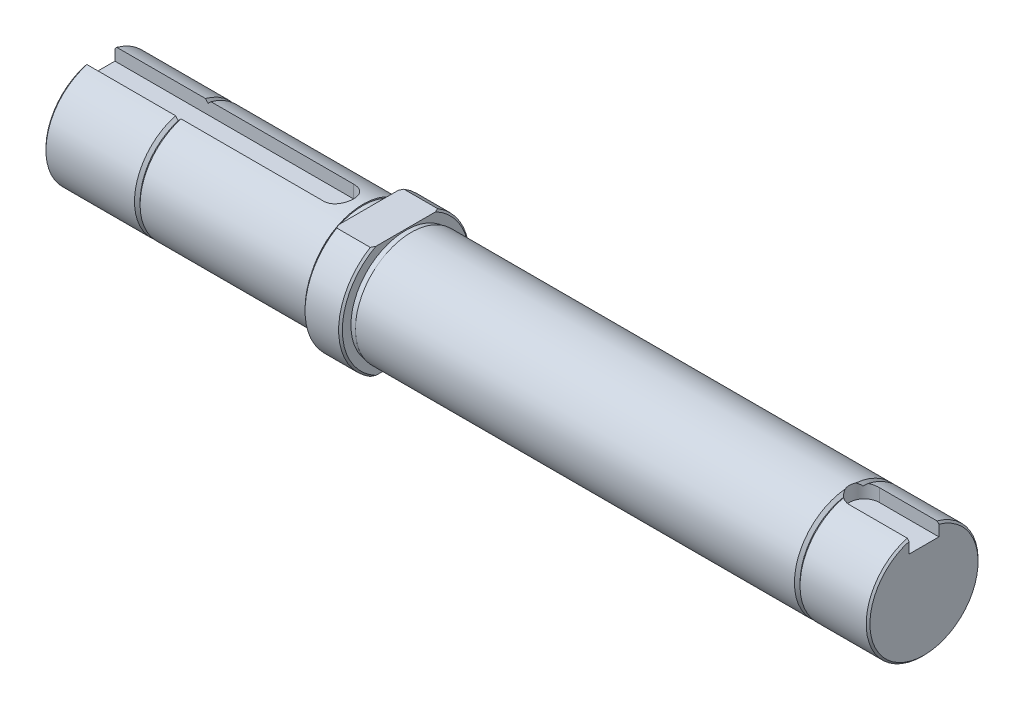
SolidWorks part; units mm, degrees
ref_plane "Front X-Y" through (0, 0, 0) normal (0, 0, 1) x (1, 0, 0)
ref_plane "Top X-Z" through (0, 0, 0) normal (0, 1, 0) x (1, 0, 0)
ref_plane "Right Y-Z" through (0, 0, 0) normal (1, 0, 0) x (0, 0, -1)
ref_plane "Plane1" through (0, 0, 0) normal (0, 0, 1) x (1, 0, 0)
sketch "Sketch1" plane through (0, 0, 0) normal (0, 0, 1) x (1, 0, 0)
  line L0 (0, 0) -> (0, 14.5)
  line L1 (0, 14.5) -> (0.5, 15)
  line L2 (0.5, 15) -> (70.5, 15)
  line L3 (70.5, 15) -> (70.5, 14.7)
  line L4 (70.5, 14.7) -> (72, 14.7)
  line L5 (72, 14.7) -> (72, 17)
  line L6 (72, 17) -> (72.5, 17.5)
  line L7 (72.5, 17.5) -> (81.5, 17.5)
  line L8 (81.5, 17.5) -> (82, 17)
  line L9 (82, 17) -> (82, 14.7)
  line L10 (82, 14.7) -> (83.5, 14.7)
  line L11 (83.5, 14.7) -> (83.5, 15)
  line L12 (83.5, 15) -> (220.5, 15)
  line L13 (220.5, 15) -> (221, 14.5)
  line L14 (221, 14.5) -> (221, 0)
  line L15 (221, 0) -> (0, 0)
  line L16 (221, 0) -> (0, 0) construction
revolve "Revolve1" add sketch "Sketch1" angle 360 about L16
ref_plane "Plane2" through (0, 15, 0) normal (0, 1, 0) x (1, 0, 0)
sketch "Sketch2" plane through (0, 15, 0) normal (0, 1, 0) x (1, 0, 0)
  line L0 (0, -4) -> (64, -4)
  line L1 (64, 4) -> (0, 4)
  line L2 (0, 4) -> (0, -4)
  arc A0 (64, -4) -> (64, 4) centre (64, 0) ccw
extrude "Cut-Extrude1" cut sketch "Sketch2" against normal blind 4
ref_plane "Plane3" through (0, 15, 0) normal (0, 1, 0) x (1, 0, 0)
sketch "Sketch3" plane through (0, 15, 0) normal (0, 1, 0) x (1, 0, 0)
  line L0 (205, -4) -> (221, -4)
  line L1 (221, -4) -> (221, 4)
  line L2 (221, 4) -> (205, 4)
  arc A0 (205, 4) -> (205, -4) centre (205, 0) ccw
extrude "Cut-Extrude2" cut sketch "Sketch3" against normal blind 4
ref_plane "Plane4" through (72, 0, 0) normal (1, 0, 0) x (0, 0, -1)
sketch "Sketch4" plane through (72, 0, 0) normal (1, 0, 0) x (0, 0, -1)
  line L0 (-70, 50) -> (-70, -50)
  line L1 (-70, -50) -> (35, -50)
  line L2 (35, -50) -> (35, -15)
  line L3 (35, -15) -> (-35, -15)
  line L4 (-35, -15) -> (-35, 15)
  line L5 (-35, 15) -> (35, 15)
  line L6 (35, 15) -> (35, 50)
  line L7 (35, 50) -> (-70, 50)
extrude "Cut-Extrude3" cut sketch "Sketch4" along normal blind 10
sketch "Sketch5" plane through (0, 0, 0) normal (0, 0, 1) x (1, 0, 0)
  line L0 (24.25, -15) -> (25, -14.25)
  line L1 (25, -14.25) -> (25.75, -15)
  line L2 (25.75, -15) -> (24.25, -15)
  line L3 (201.25, -15) -> (202, -14.25)
  line L4 (202, -14.25) -> (202.75, -15)
  line L5 (202.75, -15) -> (201.25, -15)
  line L6 (0, 13.9374) -> (0, -14.5) construction
  line L7 (221, -14.5) -> (221, 13.9374) construction
  line L8 (0.5, -15) -> (70.5, -15) construction
  line L9 (0, 0) -> (35.867, 0) construction
  dimension "D1" = 25
  dimension "D2" = 19
  dimension "D3" = 0.75
revolve "Cut-Revolve1" cut sketch "Sketch5" angle 360 about L9
